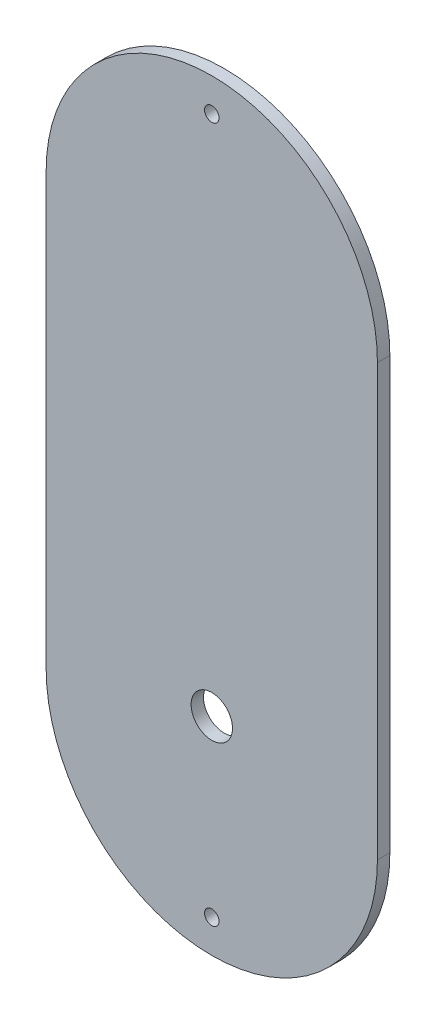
SolidWorks part; units mm, degrees
ref_plane "Front Plane" through (0, 0, 0) normal (0, 0, 1) x (1, 0, 0)
ref_plane "Top Plane" through (0, 0, 0) normal (0, 1, 0) x (1, 0, 0)
ref_plane "Right Plane" through (0, 0, 0) normal (1, 0, 0) x (0, 0, -1)
sketch "Sketch1" plane through (0, 0, 0) normal (0, 0, 1) x (1, 0, 0)
  line L0 (0, -40) -> (0, 144) construction
  line L1 (40, 104) -> (40, 0)
  line L2 (-40, 104) -> (-40, 0)
  arc A0 (-40, 0) -> (40, 0) centre (0, 0) ccw
  circle A1 centre (0, -32) radius 1.75
  circle A2 centre (0, 10) radius 5
  arc A3 (40, 104) -> (-40, 104) centre (0, 104) ccw
  circle A4 centre (0, 136) radius 1.75
  dimension "D1" = 40
  dimension "D2" = 32
  dimension "D3" = 3.5
  dimension "D4" = 10
  dimension "D5" = 10
  dimension "D6" = 32
  dimension "D7" = 3.5
  dimension "D9" = 104
extrude "Extrude1" add sketch "Sketch1" along normal blind 3
